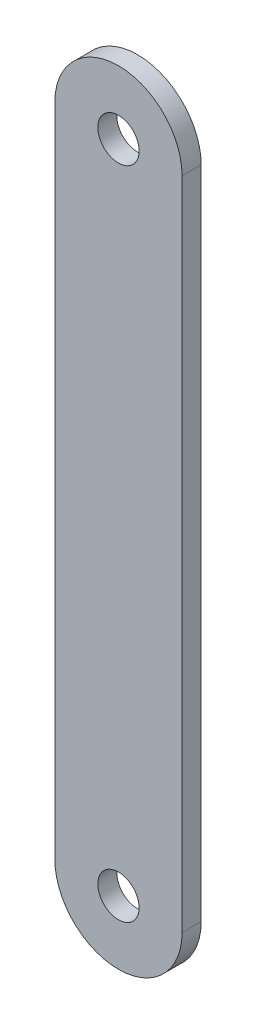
SolidWorks part; units mm, degrees
ref_plane "Front Plane" through (0, 0, 0) normal (0, 0, 1) x (1, 0, 0)
ref_plane "Top Plane" through (0, 0, 0) normal (0, 1, 0) x (1, 0, 0)
ref_plane "Right Plane" through (0, 0, 0) normal (1, 0, 0) x (0, 0, -1)
sketch "Sketch1" plane through (0, 0, 0) normal (0, 0, 1) x (1, 0, 0)
  line L0 (0, 0) -> (0, 103) construction
  line L1 (10, 0) -> (10, 103)
  line L2 (-10, 0) -> (-10, 103)
  circle A0 centre (0, 103) radius 3.25
  circle A1 centre (0, 0) radius 3.25
  arc A2 (10, 0) -> (-10, 0) centre (0, 0) cw
  arc A3 (10, 103) -> (-10, 103) centre (0, 103) ccw
  dimension "D2" = 6.5
  dimension "D1" = 103
  dimension "D3" = 10
  dimension "D4" = 10
extrude "Extrude1" add sketch "Sketch1" along normal blind 3
